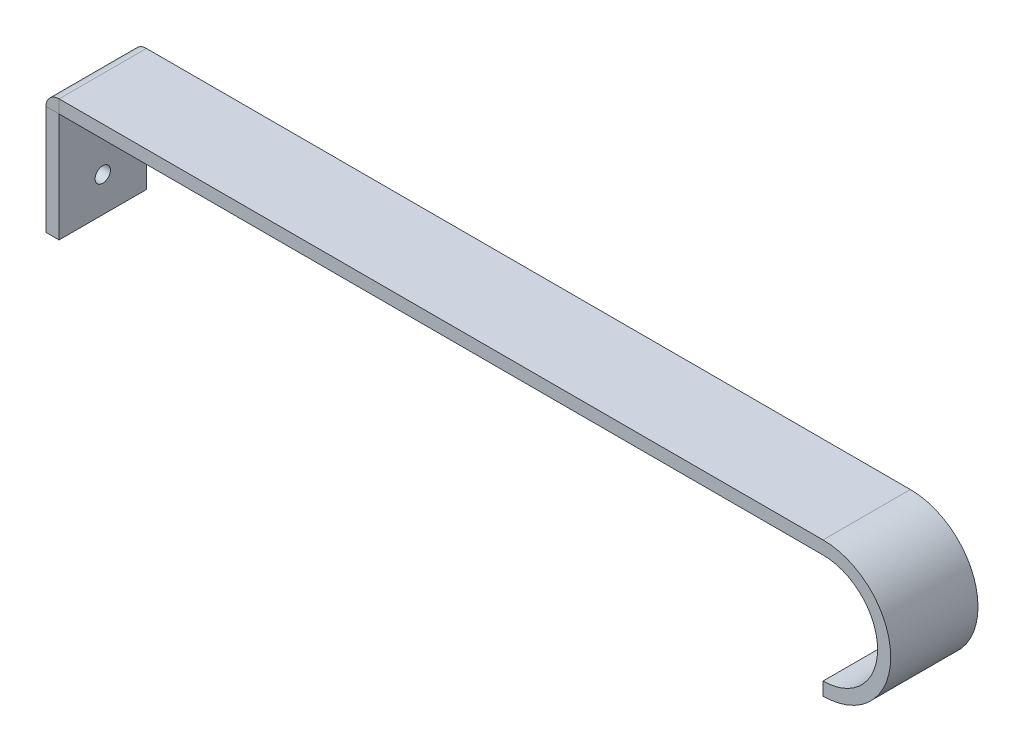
SolidWorks part; units mm, degrees
ref_plane "Front Plane" through (0, 0, 0) normal (0, 0, 1) x (1, 0, 0)
ref_plane "Top Plane" through (0, 0, 0) normal (0, 1, 0) x (1, 0, 0)
ref_plane "Right Plane" through (0, 0, 0) normal (1, 0, 0) x (0, 0, -1)
sketch "Sketch1" plane through (0, 0, 0) normal (0, 1, 0) x (1, 0, 0)
  line L0 (0, 10) -> (25.119, 10) construction
  line L1 (0, 0) -> (200, 0)
  line L2 (0, 0) -> (0, 20)
  line L3 (0, 20) -> (200, 20)
  line L4 (200, 0) -> (200, 20)
  circle A0 centre (8, 10) radius 1.75
  circle A1 centre (20, 10) radius 1.75
  dimension "D3" = 3.5
  dimension "D4" = 12
  dimension "D5" = 8
  dimension "D1" = 20
  dimension "D2" = 200
sheet metal parameters "Sheet-Metal1" thickness 3 parameters "D1"=0.0001
base flange "Base-Flange1" sketch "Sketch1" thickness 3 reverse thickness direction yes parameters "D1"=0.0001
sketch "Sketch3" plane through (0, 3, 0) normal (0, 1, 0) x (1, 0, 0)
  line L0 (25, 0) -> (25, 20)
  line L1 (0, 0) -> (200, 0) construction
  line L2 (200, 20) -> (0, 20) construction
  line L3 (0, 20) -> (0, 0) construction
  dimension "D1" = 25
sketched bend "Sketched Bend1" parameters "D1"=0.001
bend "SketchBend1" bend radius 0.0001 bend angle 90 parameters "D5"=1
sketch "Sketch4" plane through (0, 0, 0) normal (0, 0, 1) x (1, 0, 0)
  line L0 (200, 0) -> (200, -25) construction
  line L1 (200, -25) -> (200, -28)
  line L2 (200, 3) -> (200, 0)
  arc A0 (200, -25) -> (200, 0) centre (200, -12.5) ccw
  arc A1 (200, -28) -> (200, 3) centre (200, -12.5) ccw
extrude "Extrude1" add sketch "Sketch4" against normal blind 20
flat pattern "Flat-Pattern1"
sketch "Bend-Lines1" plane through (0, 0, 0) normal (0, 1, 0) x (-1, 0, 0)
bend of the flat pattern "Flatten-<SketchBend1>1"
